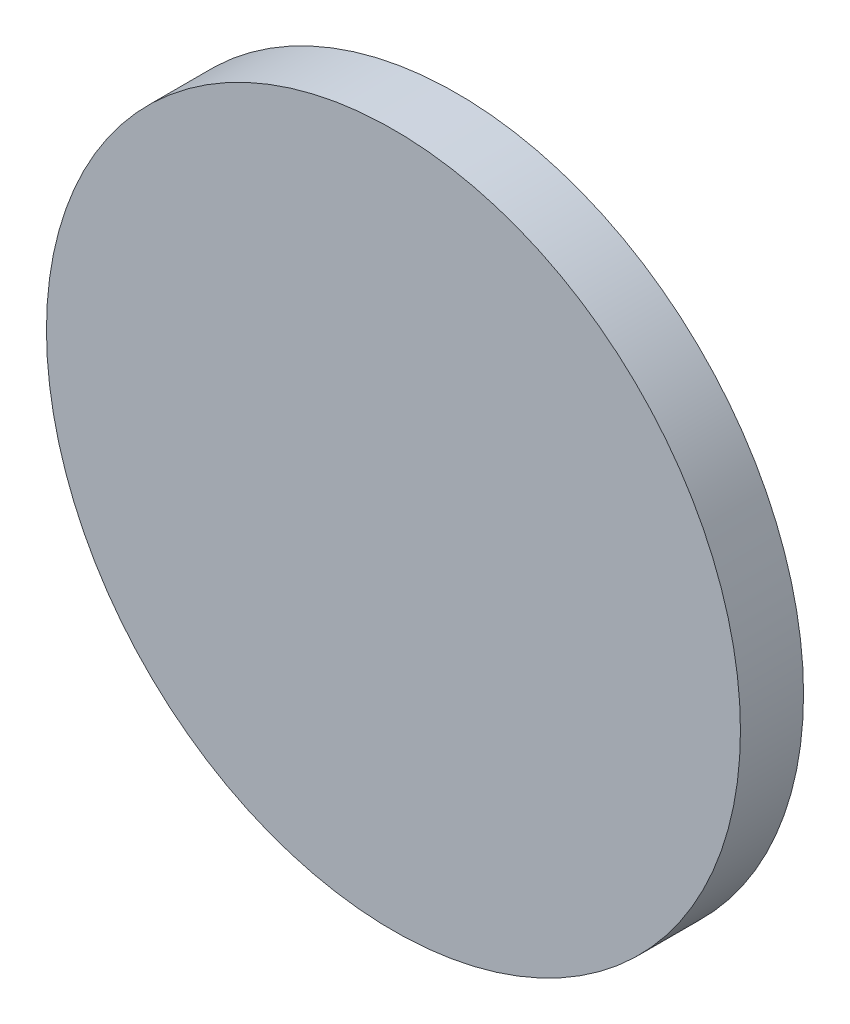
SolidWorks part; units mm, degrees
ref_plane "前视基准面" through (0, 0, 0) normal (0, 0, 1) x (1, 0, 0)
ref_plane "上视基准面" through (0, 0, 0) normal (0, 1, 0) x (1, 0, 0)
ref_plane "右视基准面" through (0, 0, 0) normal (1, 0, 0) x (0, 0, -1)
sketch "草图1" plane through (0, 0, 0) normal (0, 0, 1) x (1, 0, 0)
  circle A1 centre (0, 0) radius 16.5
  circle A2 centre (0, 0) radius 16.5
  dimension "D1" = 0
extrude "凸台-拉伸1" add sketch "草图1" along normal up to surface (3 mm away)
